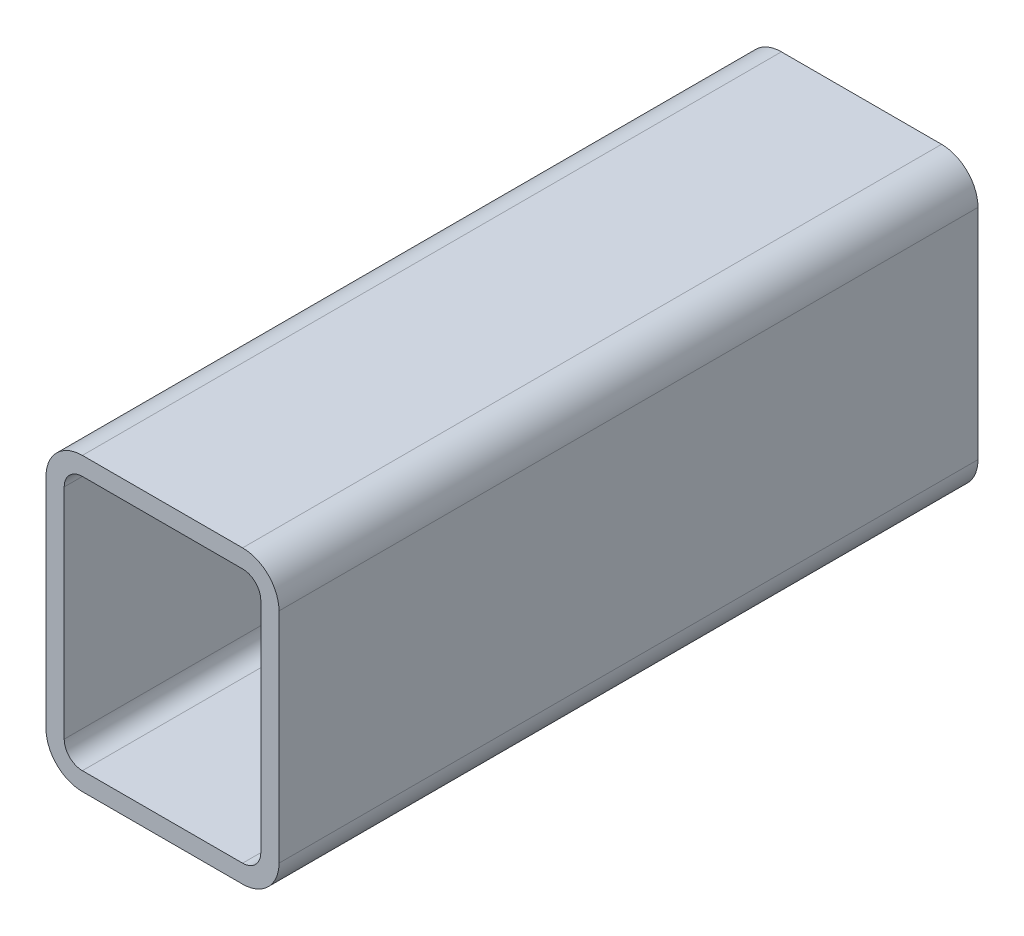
SolidWorks part; units mm, degrees
ref_plane "Front Plane" through (0, 0, 0) normal (0, 0, 1) x (1, 0, 0)
ref_plane "Top Plane" through (0, 0, 0) normal (0, 1, 0) x (1, 0, 0)
ref_plane "Right Plane" through (0, 0, 0) normal (1, 0, 0) x (0, 0, -1)
sketch "Sketch1" plane through (0, 0, 0) normal (0, 0, 1) x (1, 0, 0)
sketch_block_instance "HSS5x4x0.3125-1"
sketch_block "HSS5x4x0.3125"
extrude "Boss-Extrude1" add sketch "Sketch1" along normal blind 304.8
